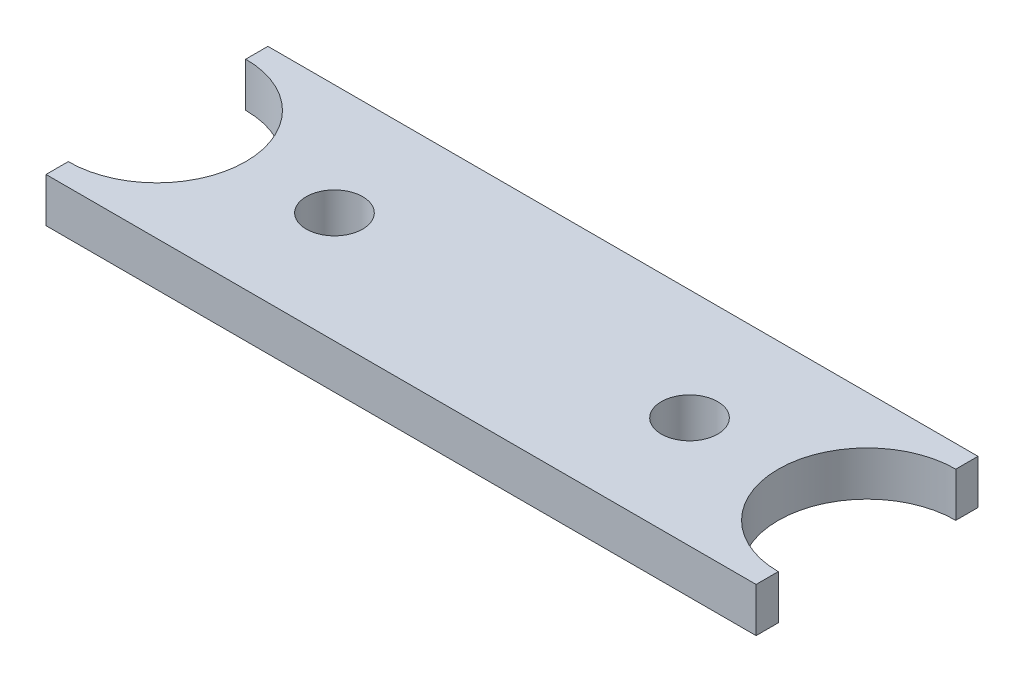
SolidWorks part; units mm, degrees
ref_plane "Front Plane" through (0, 0, 0) normal (0, 0, 1) x (1, 0, 0)
ref_plane "Top Plane" through (0, 0, 0) normal (0, 1, 0) x (1, 0, 0)
ref_plane "Right Plane" through (0, 0, 0) normal (1, 0, 0) x (0, 0, -1)
sketch "Sketch1" plane through (0, 0, 0) normal (0, 1, 0) x (1, 0, 0)
  line L0 (-20, 0) -> (20, 0) construction
  line L1 (-40, 12.5) -> (40, 12.5)
  line L2 (-40, -12.5) -> (40, -12.5)
  line L3 (40, 12.5) -> (40, 10)
  line L4 (40, -12.5) -> (40, -10)
  line L5 (0, 0) -> (0, 43.3683) construction
  line L6 (-40, -12.5) -> (-40, -10)
  line L7 (-40, 12.5) -> (-40, 10)
  arc A0 (40, 10) -> (40, -10) centre (40, 0) ccw
  arc A1 (-40, 10) -> (-40, -10) centre (-40, 0) cw
  circle A2 centre (20, 0) radius 3.175
  circle A3 centre (-20, 0) radius 3.175
  point P3 (0, 12.5)
  dimension "D4" = 10
  dimension "D5" = 6.35
  dimension "D1" = 40
  dimension "D2" = 80
  dimension "D3" = 25
extrude "Extrude1" add sketch "Sketch1" along normal blind 5
